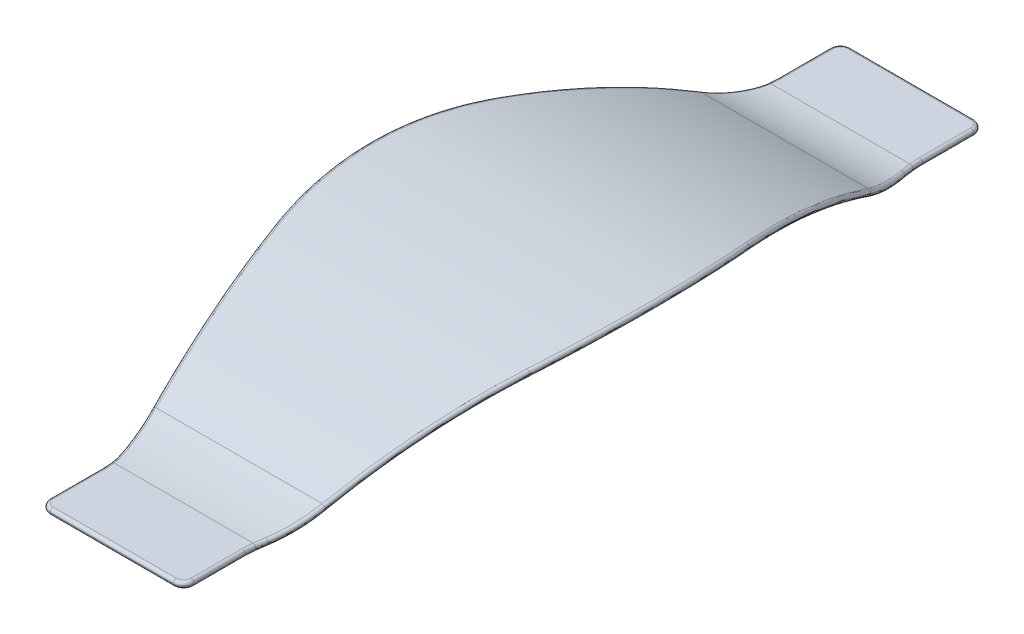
SolidWorks part; units mm, degrees
ref_plane "Front Plane" through (0, 0, 0) normal (0, 0, 1) x (1, 0, 0)
ref_plane "Top Plane" through (0, 0, 0) normal (0, 1, 0) x (1, 0, 0)
ref_plane "Right Plane" through (0, 0, 0) normal (1, 0, 0) x (0, 0, -1)
sketch "Sketch1" plane through (0, 0, 0) normal (1, 0, 0) x (0, 0, -1)
  line L0 (-390, 0) -> (390, 0) construction
  point P4 (0, 0)
  dimension "D1" = 780
sketch "Sketch2" plane through (0, 0, 0) normal (0, 1, 0) x (1, 0, 0)
  line L0 (0, 390) -> (70, 390)
  line L1 (0, -390) -> (0, 390) construction
  line L2 (70, 390) -> (70, 320)
  line L3 (0, 0) -> (137.5, 0)
  dimension "D1" = 70
  dimension "D2" = 70
  dimension "D3" = 137.5
ref_plane "Plane1" through (0, 77, 0) normal (0, 1, 0) x (1, 0, 0)
sketch "Sketch3" plane through (0, 77, 0) normal (0, 1, 0) x (1, 0, 0)
  line L0 (0, 0) -> (137.5, 0)
sketch "Sketch4" plane through (0, 0, 0) normal (1, 0, 0) x (0, 0, -1)
  line L0 (151.25, 77) -> (-151.25, 77) construction
  line L1 (-390, 0) -> (390, 0) construction
  line L2 (0, 77) -> (-72.7753, 77) construction
  line L3 (0, 77) -> (0, 0) construction
  line L4 (320, 0) -> (390, 0)
  line L5 (263.2839, 13.6473) -> (290, 0) construction
  line L6 (290, 0) -> (320, 0) construction
  arc A0 (0, 77) -> (263.2839, 13.6473) centre (0, -501.7597) cw
  arc A1 (263.2839, 13.6473) -> (320, 0) centre (320, 124.6753) ccw
  dimension "D1" = 30
extrude "Extrude-Thin1" add sketch "Sketch4" along normal mid plane 300 thin
mirror "Mirror1" about plane through (150, 77, 0) normal (0, 0, 1) of "Extrude-Thin1"
sketch "Sketch5" plane through (0, 0, 0) normal (0, 1, 0) x (1, 0, 0)
  line L0 (0, 390) -> (70, 390)
  line L1 (70, 390) -> (70, 330)
  line L2 (137.5, 0) -> (137.5, -147.2159) construction
  line L3 (0, 390) -> (0, 527.6394)
  line L4 (0, 527.6394) -> (272.3894, 527.6394)
  line L5 (272.3894, 527.6394) -> (272.3894, 0)
  line L6 (272.3894, 0) -> (137.5, 0)
  line L7 (72.4615, 310.3077) -> (124.1538, 106.7692)
  arc A0 (137.5, 0) -> (124.1538, 106.7692) centre (-296.25, 0) ccw
  arc A2 (70, 330) -> (72.4615, 310.3077) centre (150, 330) ccw
  point P17 (70, 320)
  point P18 (97.2381, 91.6927)
  dimension "D2" = 80
  dimension "D1" = 220
extrude "Cut-Extrude3" cut sketch "Sketch5" against normal through all and the other way through all contours L1 A2 L7 A0 L6 L5 L4 L3 L0
mirror "Mirror4" about plane through (0, 0, 0) normal (0, 0, 1) of "Cut-Extrude3"
mirror "Mirror5" about plane through (0, 0, 0) normal (1, 0, 0) of "Mirror4", "Cut-Extrude3"
fillet "Fillet1" radius 10 4 edges at (70, 3, 390) (-70, 3, 390) (70, 3, -390) (-70, 3, -390)
fillet "Fillet2" radius 3 56 edges at (103.7919, 45.9762, -186.9444) (78.5995, 4.6862, -286.1394) (67.0711, 0, -387.0711) (0, 0, -390) (-67.0711, 0, -387.0711) (-70, 0, -355) (-70.157, 0, -324.9902) (-78.5995, 4.6862, -286.1394) (-103.7919, 45.9762, -186.9444) (-137.5, 83, 0) (-137.5, 77, 0) (-103.7919, 45.9762, 186.9444) (-78.5995, 4.6862, 286.1394) (-70.157, 0, 324.9902) (-70, 0, 355) (-67.0711, 0, 387.0711) (0, 0, 390) (67.0711, 0, 387.0711) (70, 0, 355) (70.157, 0, 324.9902) (78.5995, 4.6862, 286.1394) (103.7919, 45.9762, 186.9444) (67.0711, 6, -387.0711) (0, 6, -390) (-67.0711, 6, -387.0711) (-70, 6, -355) (-70.157, 6, -324.9902) (-78.2428, 10.5244, -287.5438) (-103.435, 51.8361, -188.3496) (-103.435, 51.8361, 188.3496) (-78.2428, 10.5244, 287.5438) (-70.157, 6, 324.9902) (-70, 6, 355) (-67.0711, 6, 387.0711) (0, 6, 390) (67.0711, 6, 387.0711) (70, 6, 355) (70.157, 6, 324.9902) (78.2428, 10.5244, 287.5438) (103.435, 51.8361, 188.3496) (137.5, 83, 0) (103.435, 51.8361, -188.3496) (78.2428, 10.5244, -287.5438) (70.157, 6, -324.9902) (137.5, 77, 0) (70, 6, -355)
shell "Shell1" thickness 1
scale "Scale1" scale about centroid uniform scaling yes scale factor 1.015
